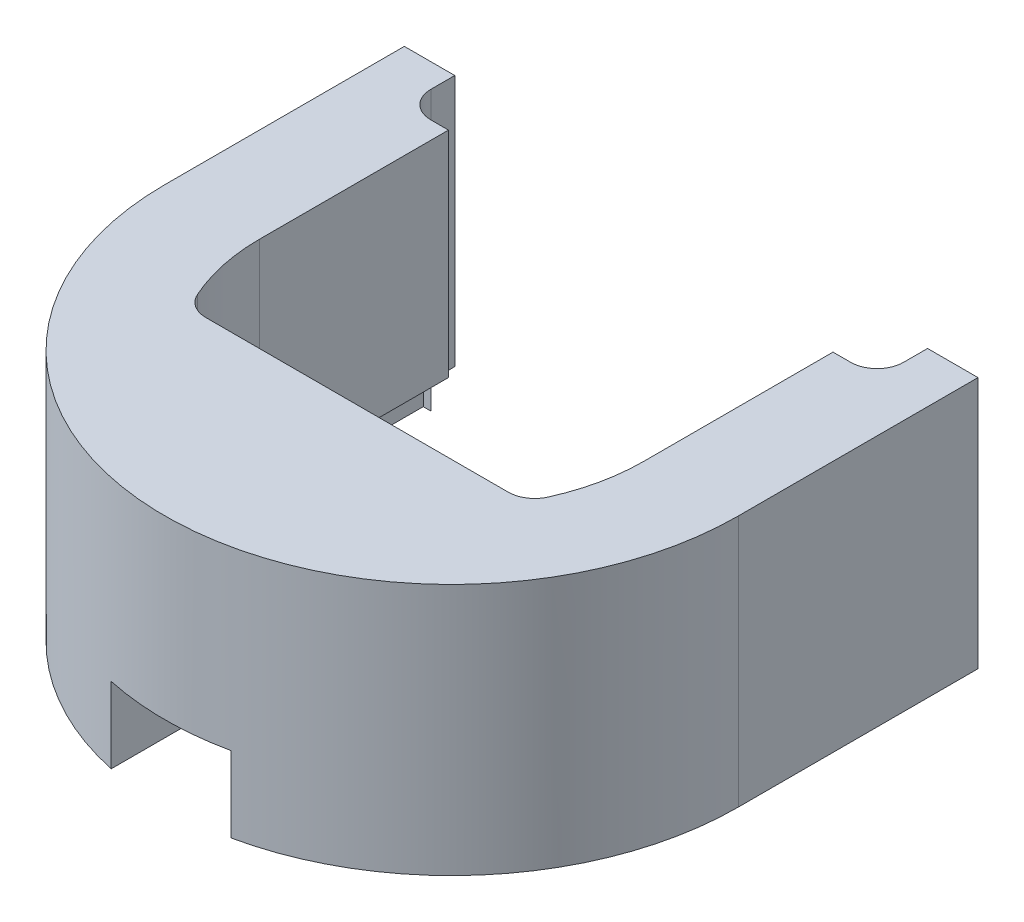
SolidWorks part; units mm, degrees
ref_plane "Plan de face" through (0, 0, 0) normal (0, 0, 1) x (1, 0, 0)
ref_plane "Plan de dessus" through (0, 0, 0) normal (0, 1, 0) x (1, 0, 0)
ref_plane "Plan de droite" through (0, 0, 0) normal (1, 0, 0) x (0, 0, -1)
sketch "Esquisse1" plane through (0, 0, 0) normal (0, 1, 0) x (1, 0, 0)
  line L0 (-9.5022, 0) -> (72.0857, 0) construction
  line L1 (37.5, 0) -> (37.5, 52.7511) construction
  line L3 (0, -36.9756) -> (0, 41.4803) construction
  line L4 (45.5, 41.4803) -> (45.5, -71.2706) construction
  line L5 (65.4792, -30) -> (-63.2154, -30) construction
  line L6 (30.5, 4.1315) -> (30.5, -40.2641) construction
  line L7 (72.0857, 8) -> (30, 8) construction
  line L8 (65.4792, -45) -> (-31.5042, -45) construction
  line L9 (-23.9802, -45) -> (23.9802, -45)
  line L10 (30.5, -30) -> (30.5, 0)
  line L11 (30.5, 0) -> (33.3, 0)
  line L12 (37.5, 4.2) -> (37.5, 8)
  line L13 (37.5, 8) -> (45.5, 8)
  line L14 (45.5, 8) -> (45.5, -30)
  line L15 (-45.5, 8) -> (-45.5, -30)
  line L16 (-30.5, -30) -> (-30.5, 0)
  line L17 (-30.5, 0) -> (-33.3, 0)
  line L18 (-37.5, 4.2) -> (-37.5, 8)
  line L19 (-37.5, 8) -> (-45.5, 8)
  arc A0 (-45.5, -30) -> (45.5, -30) centre (0, -30) ccw
  arc A1 (-30.5, -30) -> (-27.8097, -42.5247) centre (0, -30) ccw
  arc A2 (27.8097, -42.5247) -> (30.5, -30) centre (0, -30) ccw
  arc A3 (23.9802, -45) -> (27.8097, -42.5247) centre (23.9802, -40.8) ccw
  arc A4 (-23.9802, -45) -> (-27.8097, -42.5247) centre (-23.9802, -40.8) cw
  arc A5 (-37.5, 4.2) -> (-33.3, 0) centre (-33.3, 4.2) ccw
  arc A6 (37.5, 4.2) -> (33.3, 0) centre (33.3, 4.2) cw
  point P34 (26.5565, -45)
  point P37 (-26.5565, -45)
  point P40 (-37.5, 0)
  dimension "D1" = 37.5
  dimension "D2" = 4.2
  dimension "D8" = 4.2
  dimension "D3" = 8
  dimension "D4" = 30
  dimension "D5" = 15
  dimension "D6" = 8
  dimension "D7" = 15
extrude "Boss.-Extru.1" add sketch "Esquisse1" along normal blind 40
sketch "Esquisse3" plane through (0, 0, 0) normal (0, -1, 0) x (1, 0, 0)
  line L0 (30.5, -7.2186) -> (30.5, 73.3686) construction
  line L1 (34.5, -7.2186) -> (34.5, 62.1528) construction
  line L2 (0, -4.5185) -> (0, 53.8449) construction
  line L3 (-49.3804, 30) -> (55.0921, 30) construction
  line L4 (30.5, 30) -> (30.5, 0)
  line L5 (30.5, 0) -> (34.5, 0)
  line L6 (33.3, 0) -> (30.5, 0) construction
  line L7 (34.5, 0) -> (34.5, 30)
  line L8 (-30.5, 30) -> (-30.5, 0)
  line L9 (-30.5, 0) -> (-34.5, 0)
  line L10 (-34.5, 0) -> (-34.5, 30)
  line L11 (-23.9802, 45) -> (23.9802, 45)
  line L13 (-18.7523, 58) -> (18.7523, 58)
  line L14 (-9.0868, 51) -> (23.8334, 51) construction
  line L15 (9.5, 37.7482) -> (9.5, 53.8449) construction
  arc A0 (-21.3517, 57.099) -> (-34.5, 30) centre (0, 30) ccw
  arc A1 (34.5, 30) -> (21.3517, 57.099) centre (0, 30) ccw
  arc A2 (30.5, 30) -> (27.8097, 42.5247) centre (0, 30) ccw
  arc A3 (-27.8097, 42.5247) -> (-30.5, 30) centre (0, 30) ccw
  circle A4 centre (18, 51) radius 3
  circle A5 centre (-18, 51) radius 3
  arc A6 (-27.8097, 42.5247) -> (-23.9802, 45) centre (-23.9802, 40.8) cw
  arc A7 (23.9802, 45) -> (27.8097, 42.5247) centre (23.9802, 40.8) cw
  arc A8 (21.3517, 57.099) -> (18.7523, 58) centre (18.7523, 53.8) ccw
  arc A9 (-18.7523, 58) -> (-21.3517, 57.099) centre (-18.7523, 53.8) ccw
  point P43 (-20.1556, 58)
  dimension "D5" = 18
  dimension "D6" = 4.2
  dimension "D2" = 4.2
  dimension "D1" = 4
  dimension "D4" = 9.5
extrude "Enlèv. mat.-Extru.2" cut sketch "Esquisse3" against normal blind 6
sketch "Esquisse4" plane through (0, 0, 45) normal (0, 0, -1) x (-1, 0, 0)
  line L0 (0, -8.84) -> (0, 23.4986) construction
  line L1 (-55.2851, 6) -> (15.3208, 6) construction
  line L2 (-18.7523, 6) -> (18.7523, 6) construction
  line L3 (9.5, 14.0665) -> (9.5, -18.5415) construction
  line L4 (-9.5, 14.0665) -> (-9.5, -18.5415) construction
  line L5 (-55.2851, 12) -> (15.3208, 12) construction
  line L6 (-18.7523, 0) -> (18.7523, 0) construction
  line L7 (9.5, 12) -> (-9.5, 12)
  line L8 (9.5, 12) -> (9.5, 0)
  line L9 (9.5, 0) -> (-9.5, 0)
  line L10 (-9.5, 12) -> (-9.5, 0)
  dimension "D1" = 6
  dimension "D2" = 9.5
  dimension "D3" = 19
extrude "Enlèv. mat.-Extru.3" cut sketch "Esquisse4" against normal blind 32
